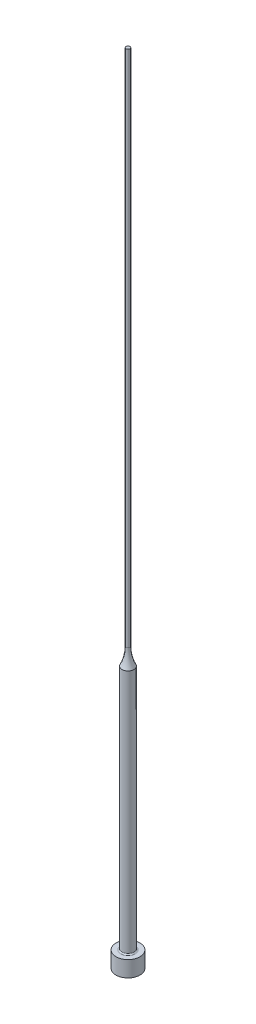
SolidWorks part; units mm, degrees
ref_plane "Front Plane" through (0, 0, 0) normal (0, 0, 1) x (1, 0, 0)
ref_plane "Top Plane" through (0, 0, 0) normal (0, 1, 0) x (1, 0, 0)
ref_plane "Right Plane" through (0, 0, 0) normal (1, 0, 0) x (0, 0, -1)
sketch "Sketch1" plane through (0, 0, 0) normal (0, 0, 1) x (1, 0, 0)
  line L0 (0, 0) -> (3, 0)
  line L1 (55, 0) -> (-55, 0) construction
  line L2 (3, 0) -> (3, 4)
  line L3 (3, 4) -> (1.8, 4)
  line L4 (1.5, 4.3) -> (1.5, 65.6411)
  line L6 (0.5, 70) -> (0.5, 200)
  line L7 (0.5, 200) -> (0, 200)
  line L8 (0, 200) -> (0, 0)
  arc A0 (0.5, 70) -> (1.5, 65.6411) centre (10.5, 70) ccw
  arc A1 (1.8, 4) -> (1.5, 4.3) centre (1.8, 4.3) cw
  dimension "D7" = 70
  dimension "D8" = 0.3
  dimension "D5" = 10
  dimension "D1" = 0.5
  dimension "D2" = 1.5
  dimension "D3" = 3
  dimension "D4" = 4
  dimension "D6" = 200
revolve "Revolve1" add sketch "Sketch1" angle 360 about L8
